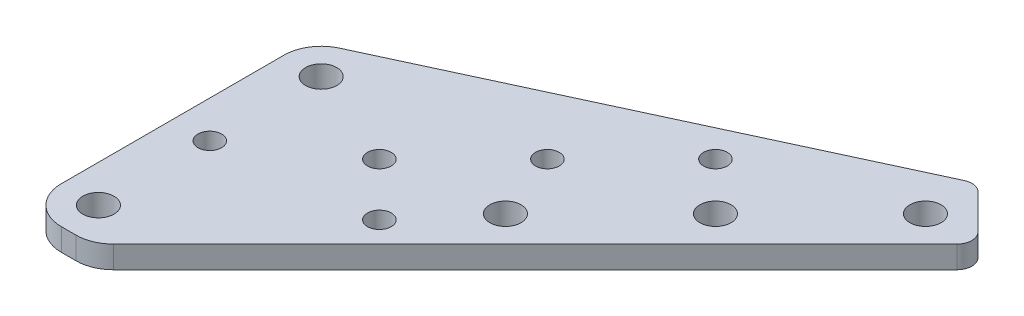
SolidWorks part; units mm, degrees
ref_plane "前视基准面" through (0, 0, 0) normal (0, 0, 1) x (1, 0, 0)
ref_plane "上视基准面" through (0, 0, 0) normal (0, 1, 0) x (1, 0, 0)
ref_plane "右视基准面" through (0, 0, 0) normal (1, 0, 0) x (0, 0, -1)
other "Configuration Table"
sketch "草图1" plane through (0, 0, 0) normal (0, 1, 0) x (1, 0, 0)
  line L0 (215.6676, 208.5965) -> (-208.5965, -215.6676) construction
  line L1 (0, 0) -> (-250, 0) construction
  line L2 (0, 0) -> (0, -250) construction
  line L3 (0, -250) -> (-250, -250) construction
  line L4 (-250, 0) -> (-250, -250) construction
  line L5 (215.6676, 208.5965) -> (208.5965, 215.6676) construction
  line L6 (-208.5965, -215.6676) -> (-215.6676, -208.5965) construction
  line L7 (208.5965, 215.6676) -> (-215.6676, -208.5965) construction
  line L8 (215.6676, 208.5965) -> (-215.6676, -208.5965) construction
  line L9 (-208.5965, -215.6676) -> (208.5965, 215.6676) construction
  line L10 (-208.5965, -208.5965) -> (-194.4544, -194.4544) construction
  line L11 (-173.2412, -180.3122) -> (-180.3122, -173.2412)
  line L12 (-180.3122, -173.2412) -> (-239.1009, -200.4628)
  line L13 (-242, -205) -> (-242, -235)
  line L14 (-237, -240) -> (-232.9289, -240)
  line L15 (-232.9289, -240) -> (-173.2412, -180.3122)
  line L16 (-200.8183, -188.0904) -> (-212.132, -199.4041) construction
  line L17 (-223.4457, -210.7178) -> (-216.3747, -217.7889) construction
  circle A0 centre (-208.5965, -208.5965) radius 2.1
  circle A1 centre (-194.4544, -194.4544) radius 2.1
  circle A2 centre (-180.3122, -180.3122) radius 2.1
  circle A3 centre (-237, -235) radius 2.1
  circle A4 centre (-237, -220) radius 1.6
  circle A5 centre (-237, -205) radius 2.1
  arc A6 (-242, -235) -> (-237, -240) centre (-237, -235) ccw
  arc A7 (-239.1009, -200.4628) -> (-242, -205) centre (-237, -205) ccw
  circle A8 centre (-200.8183, -188.0904) radius 1.6
  circle A9 centre (-212.132, -199.4041) radius 1.6
  circle A10 centre (-223.4457, -210.7178) radius 1.6
  circle A11 centre (-216.3747, -217.7889) radius 1.6
  dimension "D8" = 4.2
  dimension "D13" = 4.2
  dimension "D16" = 5
  dimension "D17" = 3.2
  dimension "D23" = 3.2
  dimension "D1" = 250
  dimension "D2" = 250
  dimension "D3" = 45
  dimension "D4" = 600
  dimension "D5" = 10
  dimension "D7" = 20
  dimension "D9" = 5
  dimension "D10" = 5
  dimension "D11" = 10
  dimension "D12" = 8
  dimension "D14" = 30
  dimension "D15" = 15
  dimension "D18" = 5
  dimension "D20" = 16
  dimension "D21" = 4
  dimension "D22" = 25
  dimension "D24" = 10
  dimension "D6" = 3
  dimension "D19" = 3
extrude "凸台-拉伸1" add sketch "草图1" along normal blind 3
fillet "圆角1" radius 2 2 edges at (-180.3122, 1.5, 173.2412) (-173.2412, 1.5, 180.3122)
fillet "圆角2" radius 5 1 edges at (-232.9289, 1.5, 240)
